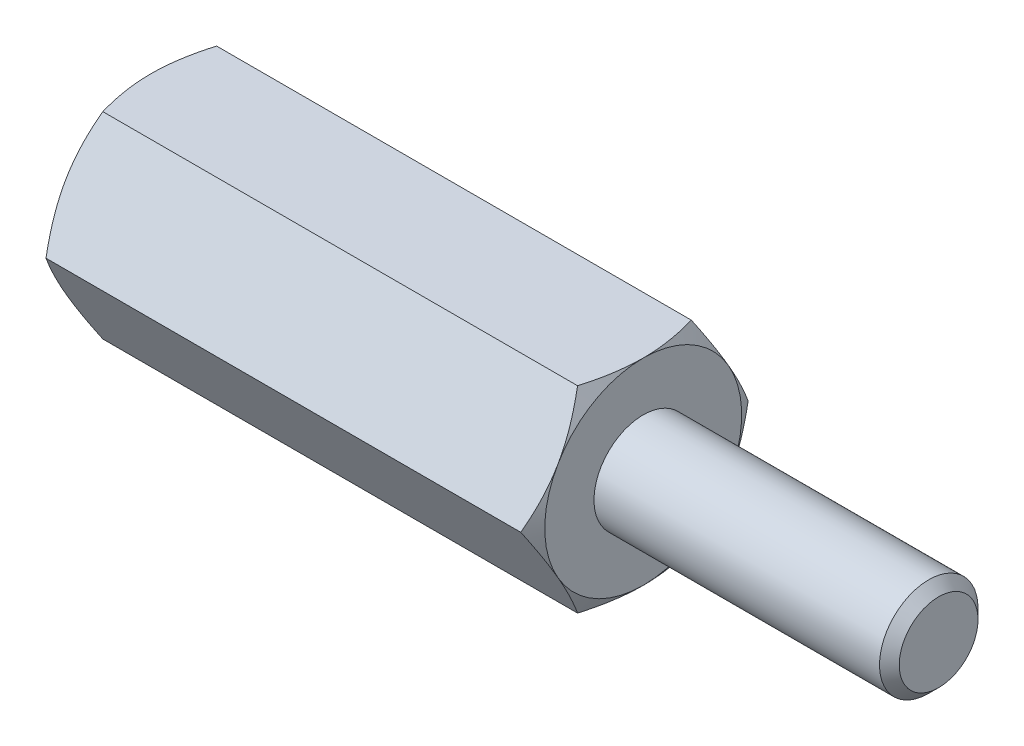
SolidWorks part; units mm, degrees
ref_plane "Front Plane" through (0, 0, 0) normal (0, 0, 1) x (1, 0, 0)
ref_plane "Top Plane" through (0, 0, 0) normal (0, 1, 0) x (1, 0, 0)
ref_plane "Right Plane" through (0, 0, 0) normal (1, 0, 0) x (0, 0, -1)
sketch "Sketch1" plane through (0, 0, 0) normal (1, 0, 0) x (0, 0, -1)
  line L1 (1.1547, 2) -> (-1.1547, 2)
  line L2 (-1.1547, 2) -> (-2.3094, 0)
  line L3 (-2.3094, 0) -> (-1.1547, -2)
  line L4 (-1.1547, -2) -> (1.1547, -2)
  line L5 (1.1547, -2) -> (2.3094, 0)
  line L6 (2.3094, 0) -> (1.1547, 2)
  circle A0 centre (0, 0) radius 2 construction
  dimension "D1" = 4
extrude "Extrude2" add sketch "Sketch1" along normal mid plane 10
sketch "Sketch2" plane through (0, 0, 0) normal (0, 0, 1) x (1, 0, 0)
  line L0 (-5, 2) -> (-3.5, 4.5981)
  line L1 (-5, 5) -> (-5, 2)
  line L3 (0, 0) -> (50000, 0) construction
  arc A0 (-3.5, 4.5981) -> (-5, 5) centre (-4.1962, 5) ccw
  dimension "D1" = 30
  dimension "D2" = 3
revolve "Cut-Revolve1" cut sketch "Sketch2" angle 360 about L3
mirror "Mirror1" about plane through (0, 0, 0) normal (1, 0, 0) of "Cut-Revolve1"
sketch "Sketch3" plane through (-5, 0, 0) normal (-1, 0, 0) x (0, 0, 1)
  circle A0 centre (0, 0) radius 0.8
  dimension "D1" = 1.6
extrude "Extrude3" cut sketch "Sketch3" against normal blind 5
sketch "Sketch4" plane through (0, 0, 0) normal (0, 0, 1) x (1, 0, 0)
  line L0 (0, 0) -> (0, 0.8)
  line L1 (4.8214, 0) -> (-4.8214, 0) construction
  line L2 (0, 0.8) -> (0.4619, 0)
  line L3 (0.4619, 0) -> (0, 0)
  line L4 (-5, 1) -> (-5, -1) construction
  point P4 (-5, 0)
  dimension "D1" = 30
  dimension "D2" = 0.8
  dimension "D3" = 5
revolve "Cut-Revolve2" cut sketch "Sketch4" angle 360 about L3
sketch "Sketch5" plane through (5, 0, 0) normal (1, 0, 0) x (0, 0, -1)
  circle A0 centre (0, 0) radius 1
  dimension "D1" = 2
extrude "Extrude4" add sketch "Sketch5" along normal blind 6
chamfer "Chamfer1" distance 0.2 angle 45 1 edges at (11, 0, -1)
equation "\"D2@Sketch4\" = \"D1@Sketch3\"/2"
